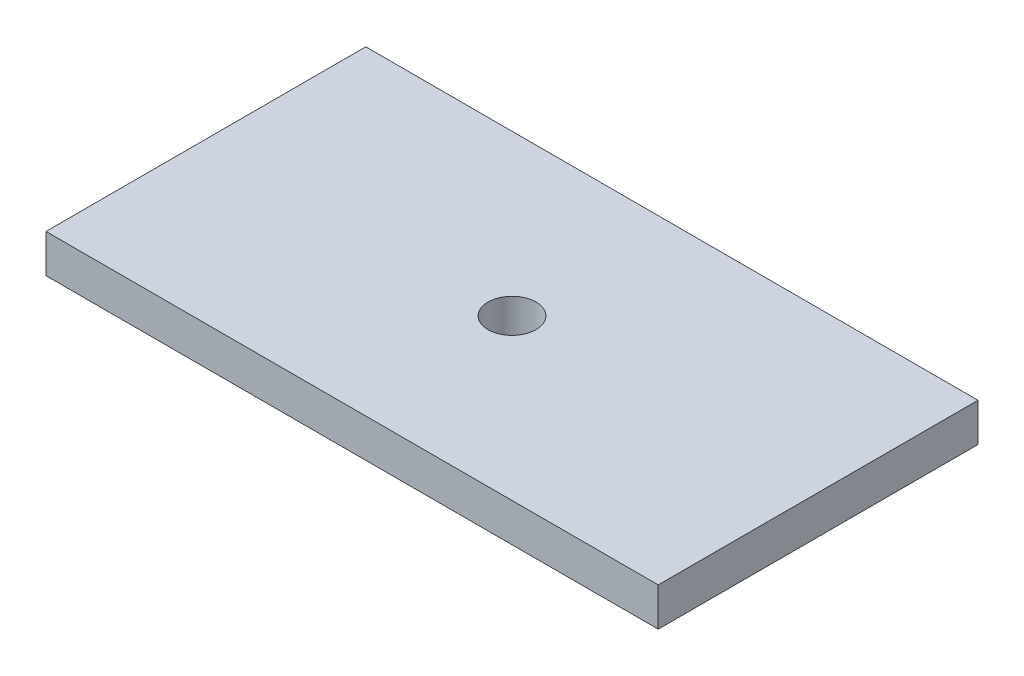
SolidWorks part; units mm, degrees
ref_plane "Front Plane" through (0, 0, 0) normal (0, 0, 1) x (1, 0, 0)
ref_plane "Top Plane" through (0, 0, 0) normal (0, 1, 0) x (1, 0, 0)
ref_plane "Right Plane" through (0, 0, 0) normal (1, 0, 0) x (0, 0, -1)
sketch "Sketch1" plane through (0, 0, 0) normal (0, 1, 0) x (1, 0, 0)
  line L1 (-60.7878, -31.75) -> (60.7878, -31.75)
  line L2 (-60.7878, -31.75) -> (-60.7878, 31.75)
  line L3 (-60.7878, 31.75) -> (60.7878, 31.75)
  line L4 (60.7878, -31.75) -> (60.7878, 31.75)
  line L5 (-60.7878, -31.75) -> (60.7878, 31.75) construction
  line L6 (-60.7878, 31.75) -> (60.7878, -31.75) construction
  circle A0 centre (0, 0) radius 68.58
  circle A1 centre (0, 0) radius 4.7625
  dimension "D1" = 63.5
  dimension "D2" = 137.16
  dimension "D3" = 9.525
extrude "Boss-Extrude1" add sketch "Sketch1" along normal blind 7.62 contours L1 L4 L3 L2 A1
